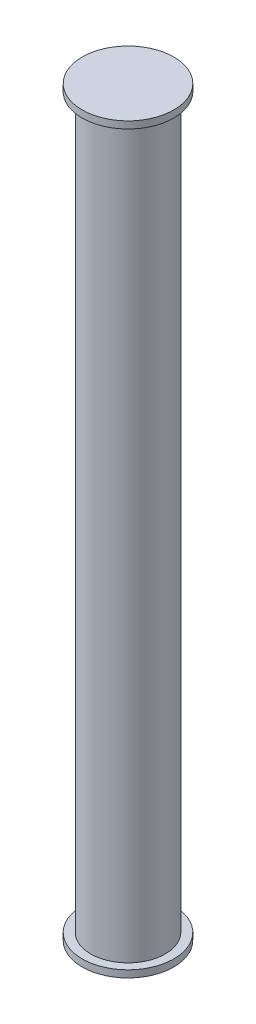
SolidWorks part; units mm, degrees
other "<MirrorRollerTube>-<<RollerTube>-<Imported1>>"
ref_plane "Front Plane" through (0, 0, 0) normal (0, 0, 1) x (1, 0, 0)
ref_plane "Top Plane" through (0, 0, 0) normal (0, 1, 0) x (1, 0, 0)
ref_plane "Right Plane" through (0, 0, 0) normal (1, 0, 0) x (0, 0, -1)
mirrored part "MirrorRollerTube_Mirrored"
